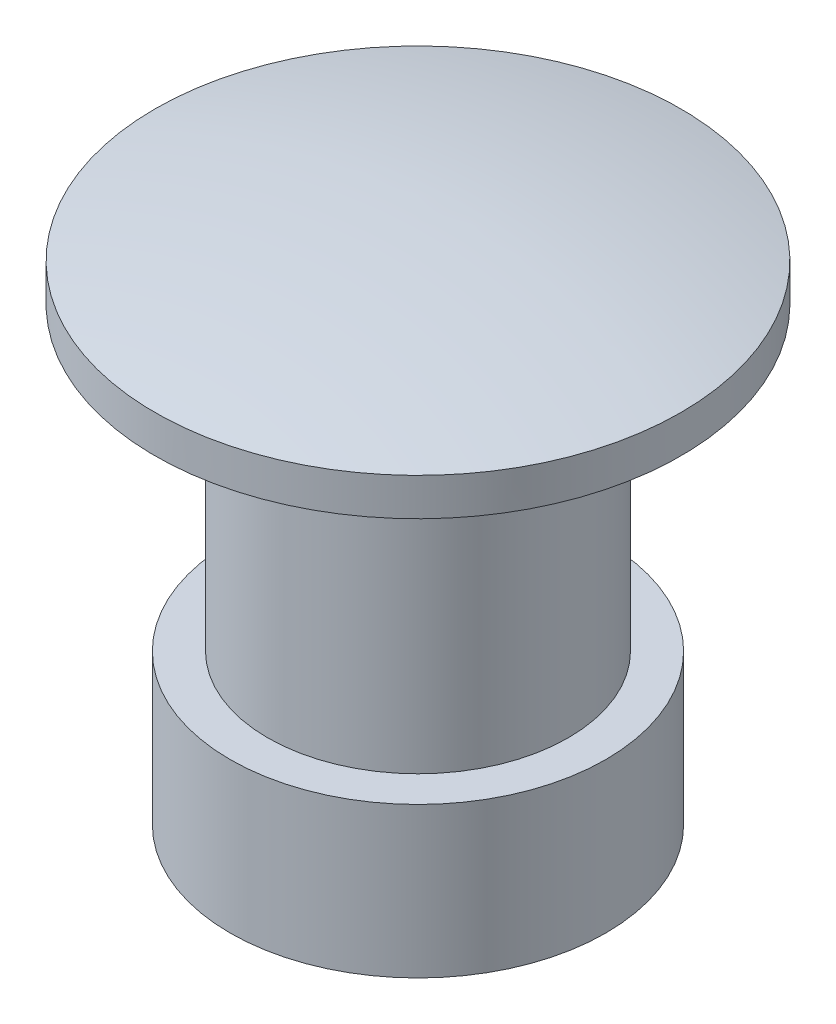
SolidWorks part; units mm, degrees
ref_plane "Face" through (0, 0, 0) normal (0, 0, 1) x (1, 0, 0)
ref_plane "Dessus" through (0, 0, 0) normal (0, 1, 0) x (1, 0, 0)
ref_plane "Droite" through (0, 0, 0) normal (1, 0, 0) x (0, 0, -1)
sketch "Esquisse1" plane through (0, 0, 0) normal (0, 0, 1) x (1, 0, 0)
  line L0 (3.5, 0) -> (2, 0)
  line L1 (2, 0) -> (2, -4)
  line L2 (3.5, 0.5) -> (3.5, 0)
  line L3 (2, -4) -> (2.5, -4)
  line L4 (0, 8.6427) -> (0, -14.6138) construction
  line L6 (2.5, -4) -> (2.5, -6)
  line L8 (2.5, -6) -> (0, -6)
  line L9 (0, 0.914) -> (0, -6)
  arc A1 (3.5, 0.5) -> (0, 0.914) centre (0, -14.086) ccw
  point P3 (0, 0)
  dimension "D7" = 15
  dimension "D1" = 3.5
  dimension "D2" = 0.5
  dimension "D3" = 4
  dimension "D4" = 2
  dimension "D5" = 2.5
  dimension "D6" = 2
revolve "Base-Révolution" add sketch "Esquisse1" angle 360 about L4
